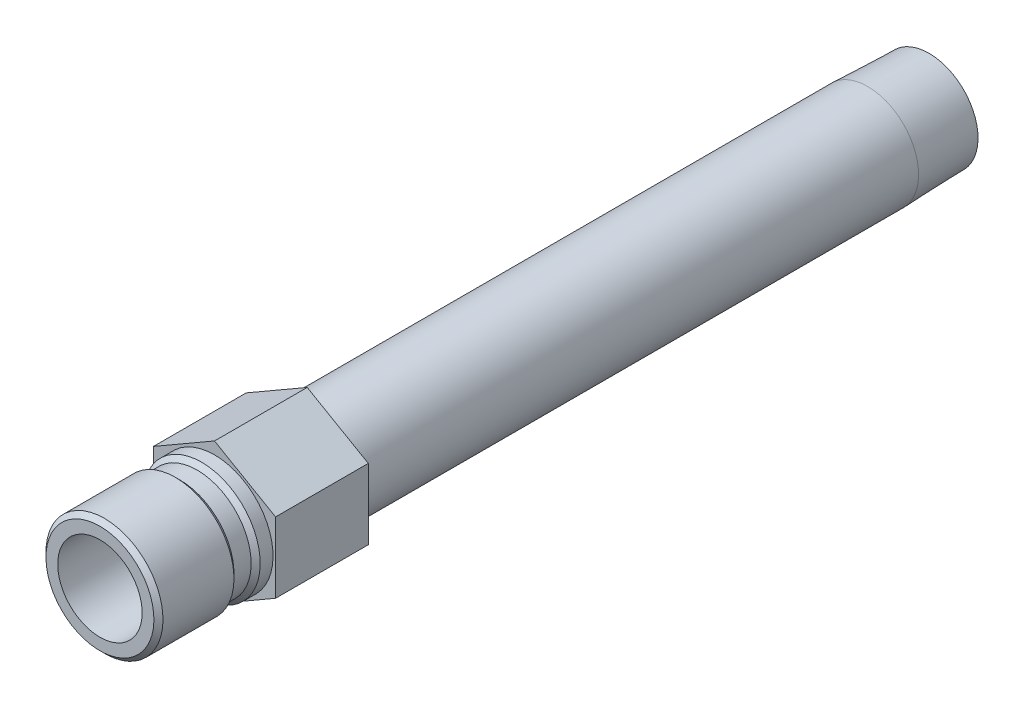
SolidWorks part; units mm, degrees
ref_plane "Front Plane" through (0, 0, 0) normal (0, 0, 1) x (1, 0, 0)
ref_plane "Top Plane" through (0, 0, 0) normal (0, 1, 0) x (1, 0, 0)
ref_plane "Right Plane" through (0, 0, 0) normal (1, 0, 0) x (0, 0, -1)
sketch "Sketch1" plane through (0, 0, 0) normal (1, 0, 0) x (0, 0, -1)
  line L0 (0, 0) -> (-22.479, 0) construction
  line L1 (-19.304, 7.112) -> (-19.304, 9.0932)
  line L2 (-5.8166, 9.0932) -> (-5.8166, 0) construction
  line L3 (-18.542, 9.8552) -> (-6.5786, 9.8552)
  line L4 (0, 8.5725) -> (0, 0) construction
  line L5 (-5.8166, 9.0932) -> (-2.921, 9.0932)
  line L6 (-2.159, 9.8552) -> (0, 9.8552)
  line L7 (0, 9.8552) -> (0, 8.5725)
  line L8 (-5.8166, 9.0932) -> (-6.5786, 9.8552)
  line L9 (-2.921, 9.0932) -> (-2.159, 9.8552)
  line L10 (-19.304, 9.0932) -> (-18.542, 9.8552)
  line L11 (-19.304, 7.112) -> (-1.524, 7.112)
  line L12 (0, 8.5725) -> (110.0582, 8.5725)
  line L13 (110.0582, 8.5725) -> (120.396, 8.2494)
  line L14 (120.396, 8.2494) -> (120.396, 6.2611)
  line L15 (0, 9.8552) -> (15.621, 9.8552) construction
  line L16 (15.621, 9.8552) -> (15.621, 0) construction
  line L17 (15.621, 0) -> (0, 0) construction
  line L18 (-1.0716, 6.2611) -> (-1.524, 7.112)
  line L19 (-1.0716, 6.2611) -> (120.396, 6.2611)
  dimension "D1" = 19.304
  dimension "D2" = 2.8956
  dimension "D3" = 0.762
  dimension "D4" = 45
  dimension "D5" = 13.4874
  dimension "D6" = 45
  dimension "D7" = 1.79
  dimension "D8" = 10.3378
  dimension "D9" = 139.7
  dimension "D10" = 3.175
  dimension "D11" = 34.925
  dimension "D12" = 14.224
  dimension "D13" = 17.145
  dimension "D14" = 19.7104
  dimension "D15" = 12.5222
  dimension "D16" = 118
  dimension "D17" = 17.78
revolve "Revolve1" add sketch "Sketch1" angle 360 about L0
sketch "Sketch2" plane through (0, 0, 0) normal (0, 0, 1) x (1, 0, 0)
  line L1 (-10.287, 5.9392) -> (-10.287, -5.9392)
  line L2 (-10.287, -5.9392) -> (0, -11.8784)
  line L3 (0, -11.8784) -> (10.287, -5.9392)
  line L4 (10.287, -5.9392) -> (10.287, 5.9392)
  line L5 (10.287, 5.9392) -> (0, 11.8784)
  line L6 (0, 11.8784) -> (-10.287, 5.9392)
  circle A0 centre (0, 0) radius 10.287 construction
  circle A1 centre (0, 0) radius 7.112 construction
  circle A2 centre (0, 0) radius 7.112
  dimension "D1" = 20.574
extrude "Boss-Extrude1" add sketch "Sketch2" against normal up to vertex (15.621 mm away) from vertex at 0
